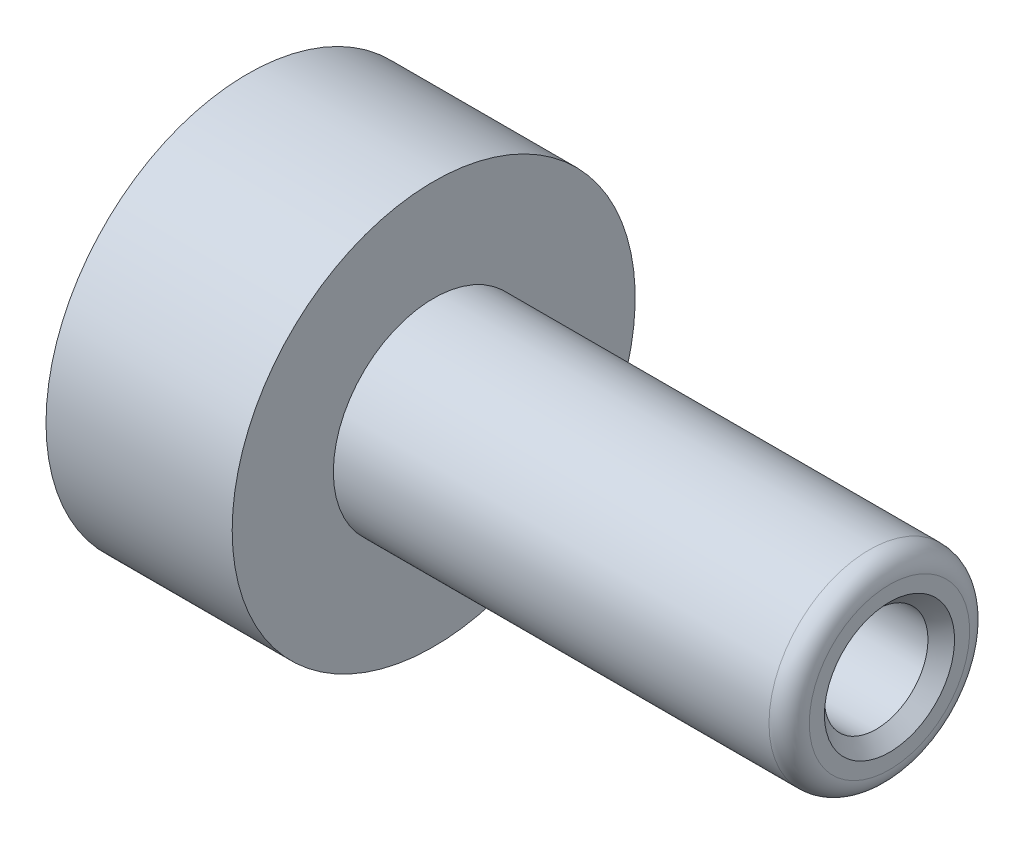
SolidWorks part; units mm, degrees
ref_plane "Front Plane" through (0, 0, 0) normal (0, 0, 1) x (1, 0, 0)
ref_plane "Top Plane" through (0, 0, 0) normal (0, 1, 0) x (1, 0, 0)
ref_plane "Right Plane" through (0, 0, 0) normal (1, 0, 0) x (0, 0, -1)
sketch "Sketch1" plane through (0, 0, 0) normal (0, 0, 1) x (1, 0, 0)
  line L0 (0, 0) -> (102.3864, 0) construction
  line L1 (0, 3.9751) -> (0, 12.7)
  line L2 (0, 12.7) -> (11.7348, 12.7)
  line L3 (11.7348, 12.7) -> (11.7348, 6.3246)
  line L4 (11.7348, 6.3246) -> (39.1922, 6.3246)
  line L5 (40.4622, 5.0546) -> (40.4622, 0)
  line L6 (40.4622, 0) -> (21.7678, 0)
  line L7 (0, 3.9751) -> (21.7678, 3.9751)
  line L8 (21.7678, 3.9751) -> (21.7678, 0)
  arc A0 (40.4622, 5.0546) -> (39.1922, 6.3246) centre (39.1922, 5.0546) ccw
  dimension "D5" = 1.27
  dimension "D1" = 11.7348
  dimension "D2" = 25.4
  dimension "D3" = 21.7678
  dimension "D4" = 7.9502
  dimension "D6" = 40.4622
  dimension "D7" = 12.6492
revolve "Revolve1" add sketch "Sketch1" angle 360 about L0
sketch "Sketch2" plane through (0, 0, 0) normal (-1, 0, 0) x (0, 0, 1)
  line L0 (0, 0) -> (9.7644, 0) construction
  circle A0 centre (0, 7.1374) radius 1.6129
  circle A1 centre (0, -7.1374) radius 1.6129
  dimension "D2" = 3.2258
  dimension "D1" = 14.2748
extrude "Cut-Extrude1" cut sketch "Sketch2" against normal blind 6.35
sketch "Sketch3" plane through (40.4622, 0, 0) normal (1, 0, 0) x (0, 0, -1)
  circle A0 centre (0, 0) radius 3.2639
  dimension "D1" = 6.5278
extrude "Cut-Extrude2" cut sketch "Sketch3" against normal blind 15.7988
chamfer "Chamfer1" distance 0.8382 angle 45 1 edges at (40.4622, 0, -3.2639)
